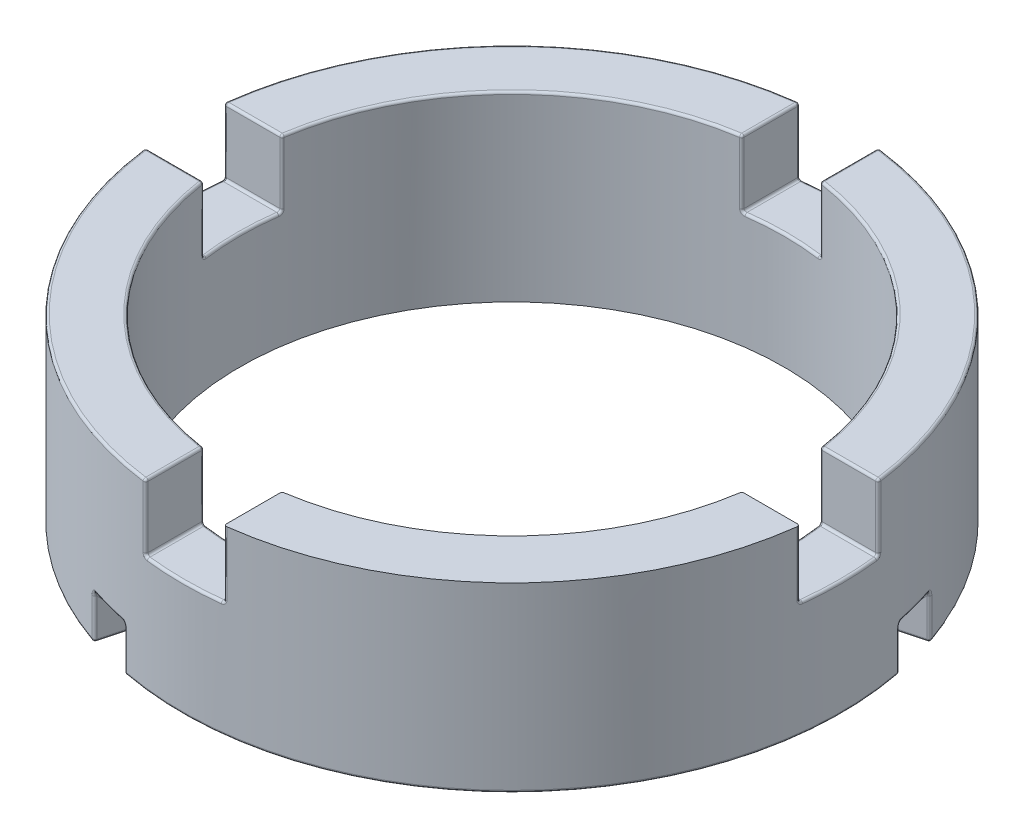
SolidWorks part; units mm, degrees
ref_plane "front" through (0, 0, 0) normal (0, 0, 1) x (1, 0, 0)
ref_plane "top" through (0, 0, 0) normal (0, 1, 0) x (1, 0, 0)
ref_plane "side" through (0, 0, 0) normal (1, 0, 0) x (0, 0, -1)
sketch "Sketch1" plane through (0, 0, 0) normal (0, 1, 0) x (1, 0, 0)
  circle A0 centre (0, 0) radius 17.3101
  circle A1 centre (0, 0) radius 14.2875
  dimension "D1" = 34.6202
  dimension "D2" = 28.575
extrude "Boss-Extrude1" add sketch "Sketch1" along normal blind 9.5631
sketch "Sketch2" plane through (0, 9.5631, 0) normal (0, 1, 0) x (1, 0, 0)
  line L0 (0, 31.7124) -> (0, -36.367) construction
  line L1 (0, -50) -> (0, 50) construction
  line L2 (-34.8081, 0) -> (38.5358, 0) construction
  line L3 (-50, 0) -> (50, 0) construction
  line L4 (-2.0574, 25.1424) -> (-2.0574, 2.0574)
  line L5 (-25.1424, -2.0574) -> (-2.0574, -2.0574)
  line L6 (2.0574, 25.1424) -> (2.0574, 2.0574)
  line L7 (-25.1424, 2.0574) -> (-2.0574, 2.0574)
  line L8 (-34.8081, 2.0574) -> (38.5358, 2.0574) construction
  line L9 (-34.8081, -2.0574) -> (38.5358, -2.0574) construction
  line L10 (2.0574, 31.7124) -> (2.0574, -36.367) construction
  line L11 (-2.0574, 31.7124) -> (-2.0574, -36.367) construction
  line L12 (2.0574, -2.0574) -> (2.0574, -25.1424)
  line L13 (2.0574, 2.0574) -> (25.1424, 2.0574)
  line L14 (-2.0574, -2.0574) -> (-2.0574, -25.1424)
  line L15 (2.0574, -2.0574) -> (25.1424, -2.0574)
  arc A0 (2.0574, 25.1424) -> (-2.0574, 25.1424) centre (0, 0) ccw
  arc A1 (25.1424, -2.0574) -> (25.1424, 2.0574) centre (0, 0) ccw
  arc A2 (-2.0574, -25.1424) -> (2.0574, -25.1424) centre (0, 0) ccw
  arc A3 (-25.1424, 2.0574) -> (-25.1424, -2.0574) centre (0, 0) ccw
  dimension "D1" = 2.0574
  dimension "D2" = 2.0574
extrude "Cut-Extrude1" cut sketch "Sketch2" against normal blind 3.4925
sketch "Sketch3" plane through (0, 0, 0) normal (0, -1, 0) x (1, 0, 0)
  line L0 (2.0574, 17.1874) -> (2.0574, 14.1386) construction
  line L1 (-2.0574, 14.1386) -> (-2.0574, 17.1874) construction
  line L2 (2.0574, 17.1874) -> (2.0574, 14.1386) construction
  line L3 (-2.0574, 14.1386) -> (-2.0574, 17.1874) construction
  line L4 (0, 0) -> (-4.9963, 18.6465) construction
  line L5 (15.135, -2.8721) -> (18.9424, -3.8923)
  line L6 (-5.0802, 14.5433) -> (-6.1004, 18.3507)
  line L7 (-6.1004, 18.3507) -> (-3.8923, 18.9424)
  line L8 (0, 0) -> (0, 18.6034) construction
  line L9 (-2.8721, 15.135) -> (-3.8923, 18.9424)
  line L10 (18.9424, -3.8923) -> (18.3507, -6.1004)
  line L11 (-1.1041, -0.2958) -> (-6.1004, 18.3507) construction
  line L12 (14.5433, -5.0802) -> (18.3507, -6.1004)
  line L13 (-10.0548, -11.6712) -> (-12.842, -14.4584)
  line L14 (-12.842, -14.4584) -> (-14.4584, -12.842)
  line L15 (-11.6712, -10.0548) -> (-14.4584, -12.842)
  arc A2 (14.5433, -5.0802) -> (15.135, -2.8721) centre (0, 0) ccw
  circle A3 centre (0, 0) radius 15.4051
  arc A4 (-2.8721, 15.135) -> (-5.0802, 14.5433) centre (0, 0) ccw
  arc A5 (-11.6712, -10.0548) -> (-10.0548, -11.6712) centre (0, 0) ccw
  point P26 (0, 0)
  dimension "D3" = 15
  dimension "D1" = 3
  dimension "D2" = 1.143
  dimension "D4" = 1.905
extrude "Cut-Extrude2" cut sketch "Sketch3" against normal blind 2.413
chamfer "Chamfer1" distance 1.905 angle 45 3 edges at (14.8802, 2.413, -3.9871) (-3.9871, 2.413, 14.8802) (-10.8931, 2.413, -10.8931)
fillet "Fillet1" radius 0.127 74 edges at (-2.0574, 7.8169, 14.1386) (-2.0574, 7.8169, 17.1874) (2.0574, 7.8169, 14.1386) (2.0574, 7.8169, 17.1874) (14.1386, 7.8169, 2.0574) (17.1874, 7.8169, 2.0574) (14.1386, 7.8169, -2.0574) (17.1874, 7.8169, -2.0574) (2.0574, 7.8169, -14.1386) (2.0574, 7.8169, -17.1874) (-2.0574, 7.8169, -14.1386) (-2.0574, 7.8169, -17.1874) (-14.1386, 7.8169, -2.0574) (-17.1874, 7.8169, -2.0574) (-14.1386, 7.8169, 2.0574) (-17.1874, 7.8169, 2.0574) (16.9796, 1.2065, -3.3664) (-3.3664, 1.2065, 16.9796) (-5.5745, 1.2065, 16.388) (-13.0216, 1.2065, -11.4052) (-11.4052, 1.2065, -13.0216) (16.388, 1.2065, -5.5745) (-10.73, 0, -12.3464) (-10.8931, 0, -10.8931) (-12.3464, 0, -10.73) (-16.7203, 0, 4.4802) (-5.3273, 0, 15.4656) (-3.9871, 0, 14.8802) (-3.1192, 0, 16.0573) (12.2401, 0, 12.2401) (16.0573, 0, -3.1192) (14.8802, 0, -3.9871) (15.4656, 0, -5.3273) (4.4802, 0, -16.7203) (16.7203, 2.413, -4.4802) (14.8802, 0.508, -3.9871) (-12.2401, 2.413, -12.2401) (-10.8931, 0.508, -10.8931) (-4.4802, 2.413, 16.7203) (-3.9871, 0.508, 14.8802) (-2.0574, 6.0706, 15.663) (0, 6.0706, 14.2875) (2.0574, 6.0706, 15.663) (0, 6.0706, 17.3101) (15.663, 6.0706, 2.0574) (14.2875, 6.0706, 0) (15.663, 6.0706, -2.0574) (17.3101, 6.0706, 0) (2.0574, 6.0706, -15.663) (0, 6.0706, -14.2875) (-2.0574, 6.0706, -15.663) (0, 6.0706, -17.3101) (-15.663, 6.0706, -2.0574) (-14.2875, 6.0706, 0) (-15.663, 6.0706, 2.0574) (-17.3101, 6.0706, 0) (-12.2401, 9.5631, 12.2401) (-15.663, 9.5631, 2.0574) (-10.1028, 9.5631, 10.1028) (-2.0574, 9.5631, 15.663) (-12.2401, 9.5631, -12.2401) (-2.0574, 9.5631, -15.663) (-10.1028, 9.5631, -10.1028) (-15.663, 9.5631, -2.0574) (12.2401, 9.5631, -12.2401) (15.663, 9.5631, -2.0574) (10.1028, 9.5631, -10.1028) (2.0574, 9.5631, -15.663)
